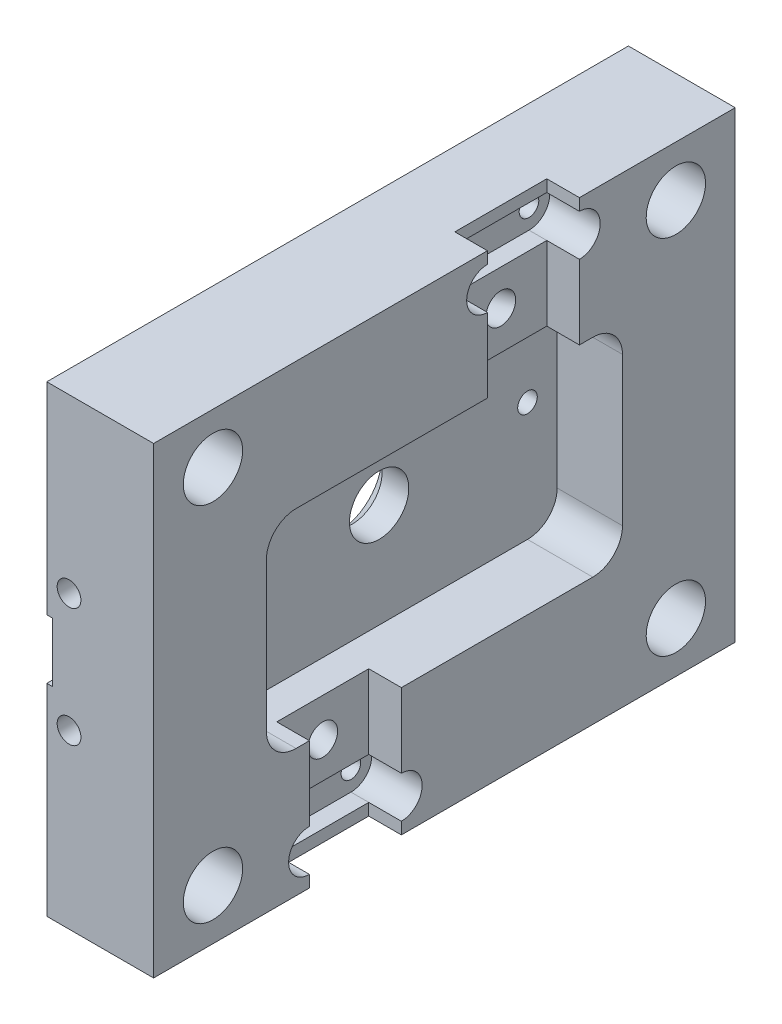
SolidWorks part; units mm, degrees
ref_plane "Face" through (0, 0, 0) normal (0, 0, 1) x (1, 0, 0)
ref_plane "Dessus" through (0, 0, 0) normal (0, 1, 0) x (1, 0, 0)
ref_plane "Droite" through (0, 0, 0) normal (1, 0, 0) x (0, 0, -1)
imported_body "Importée1"
sketch "Esquisse2" plane through (-75, 0, 0) normal (-1, 0, 0) x (0, 0, 1)
  line L0 (0, 156) -> (196, 156) construction
  line L1 (0, 0) -> (0, 156) construction
  circle A0 centre (98, 78) radius 10
  dimension "D1" = 20
  dimension "D2" = 78
  dimension "D3" = 98
extrude "Enlèv. mat.-Extru.1" cut sketch "Esquisse2" against normal through all
sketch "Esquisse1" plane through (-39, 0, 0) normal (-1, 0, 0) x (0, 0, 1)
  line L1 (48, 113) -> (148, 113)
  line L2 (38, 103) -> (38, 53)
  line L3 (48, 43) -> (148, 43)
  line L4 (158, 103) -> (158, 53)
  arc A0 (148, 43) -> (158, 53) centre (148, 53) ccw
  arc A1 (148, 113) -> (158, 103) centre (148, 103) cw
  arc A2 (48, 113) -> (38, 103) centre (48, 103) ccw
  arc A3 (38, 53) -> (48, 43) centre (48, 53) ccw
  circle A4 centre (98, 78) radius 10 construction
  point P8 (158, 113)
  point P11 (38, 113)
  point P14 (38, 43)
  dimension "D3" = 10
  dimension "D1" = 120
  dimension "D2" = 70
  dimension "D4" = 60
  dimension "D5" = 35
extrude "Enlèv. mat.-Extru.2" cut sketch "Esquisse1" along normal blind 22
sketch "Esquisse3" plane through (0, 0, 0) normal (0, 1, 0) x (-1, 0, 0)
  line L0 (39, 143.5) -> (39, 112.5)
  line L1 (39, 196) -> (39, 0) construction
  line L2 (39, 143.5) -> (50, 143.5)
  line L5 (50, 143.5) -> (50, 112.5)
  line L8 (50, 112.5) -> (39, 112.5)
  line L9 (61, 98) -> (75, 98) construction
  dimension "D1" = 31
  dimension "D2" = 11
  dimension "D5" = 14.5
extrude "Enlèv. mat.-Extru.3" cut sketch "Esquisse3" along normal up to next
sketch "Esquisse4" plane through (0, 156, 0) normal (0, -1, 0) x (1, 0, 0)
  line L0 (-39, 52.5) -> (-39, 83.5)
  line L1 (-39, 0) -> (-39, 112.5) construction
  line L2 (-39, 83.5) -> (-50, 83.5)
  line L5 (-50, 83.5) -> (-50, 52.5)
  line L8 (-50, 52.5) -> (-39, 52.5)
  line L9 (-61, 98) -> (-75, 98) construction
  dimension "D1" = 11
  dimension "D4" = 31
  dimension "D5" = 14.5
extrude "Enlèv. mat.-Extru.4" cut sketch "Esquisse4" along normal up to next
hole_wizard "Dégagement M71" positions "Esquisse6" profile "Esquisse5" hole size "M7" standard "Ansi Métrique"
sketch "Esquisse6" plane through (0, 0, 196) normal (0, 0, 1) x (1, 0, 0)
  line L0 (-61, 78) -> (-75, 78) construction
  line L1 (-75, 156) -> (-75, 0) construction
  point P0 (-67.5, 58)
  point P1 (-67.5, 98)
  dimension "D1" = 20
  dimension "D2" = 20
  dimension "D3" = 7.5
sketch "Esquisse5" plane through (-67.5, 58, 196) normal (1, 0, 0) x (0, -1, 0)
  line L0 (0, 0) -> (0, 137.4034)
  line L1 (0, 137.4034) -> (4, 135)
  line L2 (4, 135) -> (4, 0)
  line L5 (4, 0) -> (0, 0)
  line L10 (0, 137.4034) -> (-4, 135) construction
  line L11 (0, -6.35) -> (0, 107.95) construction
  dimension "Diamètre du perçage" = 8
  dimension "Profondeur du perçage" = 135
  dimension "Angle de pointe" = 118
hole_wizard "Dégagement M72" positions "Esquisse8" profile "Esquisse7" hole size "M7" standard "Ansi Métrique"
sketch "Esquisse8" plane through (0, 0, 0) normal (0, -1, 0) x (1, 0, 0)
  line L0 (-67.5, 61) -> (-67.5, 196) construction
  line L1 (-61, 98) -> (-75, 98) construction
  point P0 (-67.5, 68)
  dimension "D1" = 30
sketch "Esquisse7" plane through (-67.5, 0, 68) normal (1, 0, 0) x (0, 0, -1)
  line L0 (0, 0) -> (0, 107.4034)
  line L1 (0, 107.4034) -> (4, 105)
  line L2 (4, 105) -> (4, 0)
  line L5 (4, 0) -> (0, 0)
  line L10 (0, 107.4034) -> (-4, 105) construction
  line L11 (0, -6.35) -> (0, 107.95) construction
  dimension "Diamètre du perçage" = 8
  dimension "Profondeur du perçage" = 105
  dimension "Angle de pointe" = 118
chamfer "Chanfrein1" distance 5 angle 45
hole_wizard "Chambrage pour vis à tête cylindrique à 6 pans creux (vis CHC) M61" positions "Esquisse11" profile "Esquisse10" counterbore size "M6" standard "ISO"
sketch "Esquisse11" plane through (-75, 0, 0) normal (-1, 0, 0) x (0, 0, 1)
  point P0 (148, 78)
  point P1 (48, 83)
  dimension "D1" = 50
  dimension "D2" = 50
  dimension "D3" = 5
sketch "Esquisse10" plane through (-75, 78, 148) normal (0, 1, 0) x (0, 0, 1)
  line L0 (0, 0) -> (0, 36)
  line L1 (0, 36) -> (3.3, 36)
  line L3 (3.3, 36) -> (3.3, 7)
  line L4 (3.3, 7) -> (5.5, 7)
  line L5 (5.5, 7) -> (5.5, 0)
  line L7 (5.5, 0) -> (0, 0)
  line L11 (0, -6.35) -> (0, 107.95) construction
  dimension "Diamètre du perçage jusqu'au prochain" = 6.6
  dimension "Profondeur du perçage jusqu'au prochain" = 36
  dimension "Diamètre du chambrage" = 11
  dimension "Profondeur du chambrage" = 7
sketch "Esquisse12" plane through (-39, 0, 0) normal (1, 0, 0) x (0, 0, -1)
  line L0 (-112.5, 43) -> (-112.5, 0) construction
  line L1 (-112.5, 18) -> (-143.5, 18)
  line L2 (-143.5, 43) -> (-143.5, 0) construction
  line L3 (-112.5, 4) -> (-143.5, 4)
  line L4 (0, 0) -> (-112.5, 0) construction
  line L5 (-83.5, 113) -> (-83.5, 156) construction
  line L6 (-83.5, 152) -> (-52.5, 152)
  line L7 (-52.5, 113) -> (-52.5, 156) construction
  line L8 (-83.5, 138) -> (-52.5, 138)
  line L9 (-196, 156) -> (-83.5, 156) construction
  arc A0 (-112.5, 4) -> (-112.5, 18) centre (-112.5, 11) ccw
  arc A1 (-143.5, 4) -> (-143.5, 18) centre (-143.5, 11) cw
  arc A2 (-83.5, 152) -> (-83.5, 138) centre (-83.5, 145) ccw
  arc A3 (-52.5, 138) -> (-52.5, 152) centre (-52.5, 145) ccw
  dimension "D2" = 7
  dimension "D1" = 18
  dimension "D3" = 18
extrude "Enlèv. mat.-Extru.5" cut sketch "Esquisse12" against normal blind 17
hole_wizard "Chambrage pour vis à tête cylindrique à 6 pans creux (vis CHC) M62" positions "Esquisse14" profile "Esquisse13" counterbore size "M6" standard "ISO"
sketch "Esquisse14" plane through (-75, 0, 0) normal (-1, 0, 0) x (0, 0, 1)
  point P0 (52.5, 145)
  point P1 (143.5, 11)
  point P2 (112.5, 11)
  point P4 (83.5, 145)
sketch "Esquisse13" plane through (-75, 145, 52.5) normal (0, 1, 0) x (0, 0, 1)
  line L0 (0, 0) -> (0, 36)
  line L1 (0, 36) -> (3.3, 36)
  line L3 (3.3, 36) -> (3.3, 7)
  line L4 (3.3, 7) -> (5.5, 7)
  line L5 (5.5, 7) -> (5.5, 0)
  line L7 (5.5, 0) -> (0, 0)
  line L11 (0, -6.35) -> (0, 107.95) construction
  dimension "Diamètre du perçage jusqu'au prochain" = 6.6
  dimension "Profondeur du perçage jusqu'au prochain" = 36
  dimension "Diamètre du chambrage" = 11
  dimension "Profondeur du chambrage" = 7
sketch "Esquisse15" plane through (-50, 0, 0) normal (1, 0, 0) x (0, 0, -1)
  line L0 (-83.5, 125.92) -> (-52.5, 125.92) construction
  line L1 (-83.5, 113) -> (-83.5, 138) construction
  line L2 (-52.5, 113) -> (-52.5, 138) construction
  line L3 (-143.5, 30.08) -> (-112.5, 30.08) construction
  line L4 (-143.5, 43) -> (-143.5, 18) construction
  line L5 (-112.5, 43) -> (-112.5, 18) construction
  line L6 (-52.5, 156) -> (0, 156) construction
  line L7 (0, 0) -> (-112.5, 0) construction
  dimension "D1" = 30.08
  dimension "D2" = 30.08
ref_plane "Plan1" through (-54.1706, 14.515, 0) normal (0.9659, -0.2588, 0) x (0, 0, -1)
sketch "Esquisse16" plane through (-54.1706, 14.515, 0) normal (0.9659, -0.2588, 0) x (0, 0, -1)
  line L0 (-143.5, 16.1141) -> (-112.5, 16.1141) construction
  circle A0 centre (-128, 16.1141) radius 5
  dimension "D1" = 10
extrude "Enlèv. mat.-Extru.6" cut sketch "Esquisse16" against normal through all and the other way through all
ref_plane "Plan2" through (-15.1706, -4.065, 0) normal (0.9659, 0.2588, 0) x (0, 0, -1)
sketch "Esquisse17" plane through (-15.1706, -4.065, 0) normal (0.9659, 0.2588, 0) x (0, 0, -1)
  line L0 (-83.5, 134.5703) -> (-52.5, 134.5703) construction
  circle A0 centre (-68, 134.5703) radius 5
  dimension "D1" = 10
extrude "Enlèv. mat.-Extru.7" cut sketch "Esquisse17" against normal through all and the other way through all
ref_plane "Plan3" through (-36.421, -9.759, 0) normal (0.9659, 0.2588, 0) x (0, 0, -1)
sketch "Esquisse18" plane through (-36.421, -9.759, 0) normal (0.9659, 0.2588, 0) x (0, 0, -1)
  circle A0 centre (-68, 134.5703) radius 7.5
  circle A1 centre (-68, 134.5703) radius 5 construction
  dimension "D1" = 15
extrude "Enlèv. mat.-Extru.8" cut sketch "Esquisse18" against normal through all
ref_plane "Plan4" through (-75.421, 20.209, 0) normal (0.9659, -0.2588, 0) x (0, 0, -1)
sketch "Esquisse19" plane through (-75.421, 20.209, 0) normal (0.9659, -0.2588, 0) x (0, 0, -1)
  circle A0 centre (-128, 16.1141) radius 7.5
  circle A1 centre (-128, 16.1141) radius 5 construction
  dimension "D1" = 15
extrude "Enlèv. mat.-Extru.9" cut sketch "Esquisse19" against normal through all
sketch "Esquisse20" plane through (-75, 0, 0) normal (-1, 0, 0) x (0, 0, 1)
  point P0 (68, 119.2213)
sketch "Esquisse21" plane through (-75, 0, 0) normal (-1, 0, 0) x (0, 0, 1)
  line L0 (188, 88) -> (196, 88)
  line L1 (196, 88) -> (196, 68)
  line L2 (196, 68) -> (188, 68)
  line L3 (8, 68) -> (0, 68)
  line L4 (8, 88) -> (0, 88)
  line L5 (0, 88) -> (0, 68)
  line L6 (196, 156) -> (196, 0) construction
  line L7 (0, 0) -> (0, 156) construction
  arc A0 (188, 68) -> (188, 88) centre (188, 78) cw
  arc A1 (8, 88) -> (8, 68) centre (8, 78) cw
  dimension "D3" = 10
  dimension "D4" = 10
  dimension "D1" = 8
  dimension "D2" = 8
extrude "Enlèv. mat.-Extru.10" cut sketch "Esquisse21" against normal blind 2
